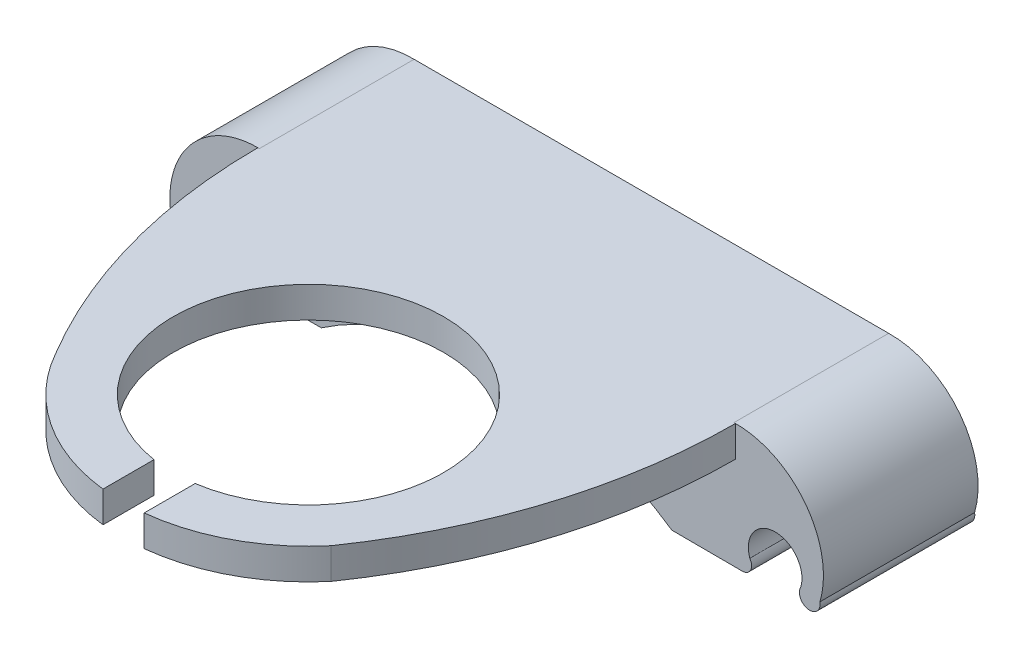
SolidWorks part; units mm, degrees
ref_plane "Спереди" through (0, 0, 0) normal (0, 0, 1) x (1, 0, 0)
ref_plane "Сверху" through (0, 0, 0) normal (0, 1, 0) x (1, 0, 0)
ref_plane "Справа" through (0, 0, 0) normal (1, 0, 0) x (0, 0, -1)
sketch "Эскиз1" plane through (0, 0, 0) normal (0, 0, 1) x (1, 0, 0)
  line L0 (-48.7532, 0) -> (-55.5749, -0.0256)
  line L1 (-31.7671, 17.1838) -> (-31.7671, -1.86) construction
  line L2 (-54.7671, 12.0369) -> (-8.7671, 12.0369)
  line L3 (-14.781, 0) -> (-7.9593, -0.0256)
  arc A0 (-55.5749, -0.0256) -> (-56.3098, 1.4127) centre (-55.5783, 0.8796) cw
  arc A1 (-48.7532, 0) -> (-14.781, 0) centre (-31.7671, -24.9703) cw
  arc A2 (-56.3098, 1.4127) -> (-61.2237, 1.4107) centre (-58.7671, 2.2623) ccw
  arc A3 (-61.2237, 1.4107) -> (-63.0957, 1.1525) centre (-62.115, 0.9573) cw
  arc A4 (-63.0957, 1.1525) -> (-54.7671, 12.0369) centre (-54.9375, 3.5386) cw
  arc A5 (-0.4385, 1.1525) -> (-8.7671, 12.0369) centre (-8.5967, 3.5386) ccw
  arc A6 (-2.3105, 1.4107) -> (-0.4385, 1.1525) centre (-1.4192, 0.9573) ccw
  arc A7 (-7.2244, 1.4127) -> (-2.3105, 1.4107) centre (-4.7671, 2.2623) cw
  arc A8 (-7.9593, -0.0256) -> (-7.2244, 1.4127) centre (-7.9559, 0.8796) ccw
  point P31 (-31.7671, 12.0369)
  dimension "D1" = 30.2
  dimension "D3" = 2.6
  dimension "D4" = 1
  dimension "D6" = 8.5
  dimension "D2" = 54
  dimension "D5" = 46
  dimension "D7" = 6.8217
extrude "Бобышка-Вытянуть1" add sketch "Эскиз1" along normal blind 15
sketch "Эскиз2" plane through (0, 12.0369, 0) normal (0, -1, 0) x (1, 0, 0)
  line L0 (-54.9144, 15) -> (-8.6198, 15)
  line L1 (-31.7671, 15) -> (-31.7671, 0) construction
  line L2 (-14.781, 15) -> (-48.7532, 15) construction
  line L3 (-48.7532, 0) -> (-14.781, 0) construction
  circle A0 centre (-31.7382, 33.271) radius 13.1
  arc A1 (-17.9569, 44.8509) -> (-47.4533, 42.0489) centre (-31.7382, 33.271) ccw
  arc A2 (-8.6198, 15) -> (-17.9569, 44.8509) centre (-61.005, 15) ccw
  arc A3 (-54.9144, 15) -> (-47.4533, 42.0489) centre (-2.1534, 15) cw
  dimension "D2" = 18.0005
  dimension "D1" = 26.2
  dimension "D3" = 52.7611
  dimension "D4" = 52.3852
  dimension "D5" = 18.271
extrude "Бобышка-Вытянуть2" add sketch "Эскиз2" along normal blind 3
sketch "Эскиз3" plane through (0, 12.0369, 0) normal (0, 1, 0) x (1, 0, 0)
  line L0 (-31.7382, -46.371) -> (-31.7382, -51.2715) construction
  line L1 (-36.8577, -45.3292) -> (-38.7728, -49.84)
  line L2 (-26.6187, -45.3292) -> (-24.7036, -49.84)
  arc A0 (-36.8577, -45.3292) -> (-26.6187, -45.3292) centre (-31.7382, -33.271) ccw
  arc A1 (-38.7728, -49.84) -> (-24.7036, -49.84) centre (-31.7382, -33.271) ccw
  circle A2 centre (-31.7382, -33.271) radius 13.1 construction
  arc A3 (-47.4533, -42.0489) -> (-17.9569, -44.8509) centre (-31.7382, -33.271) ccw construction
  dimension "D1" = 10.2389
extrude "Бобышка-Вытянуть3" [suppressed] add sketch "Эскиз3" along normal blind 8
fillet "Скругление1" [suppressed] radius 4
ref_plane "Плоскость5" through (0, 0, 25) normal (0, 0, 1) x (1, 0, 0)
sketch "Эскиз4" plane through (0, 0, 25) normal (0, 0, 1) x (1, 0, 0)
  line L0 (-31.7671, 9.0369) -> (-31.7671, 26.1069) construction
  line L1 (-54.9144, 9.0369) -> (-8.6198, 9.0369) construction
  line L3 (-34.915, 20.0369) -> (-28.5614, 20.0369) construction
  line L4 (-33.7671, 15.5369) -> (-33.7671, 6.9649)
  line L5 (-33.7671, 6.9649) -> (-29.7671, 6.9649)
  line L6 (-29.7671, 6.9649) -> (-29.7671, 15.5369)
  arc A0 (-29.7671, 15.5369) -> (-33.7671, 15.5369) centre (-31.7671, 15.5369) ccw
  dimension "D1" = 4
  dimension "D2" = 4.5
extrude "Вырез-Вытянуть1" cut sketch "Эскиз4" along normal through all
